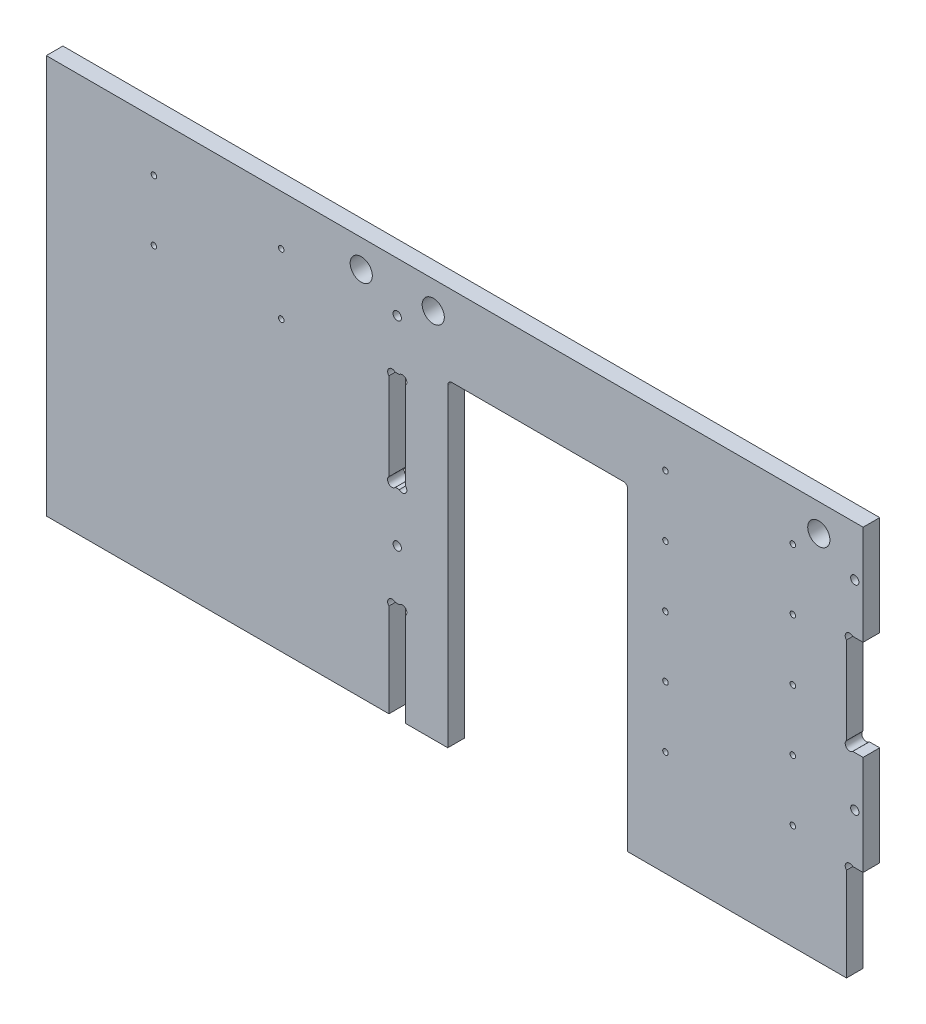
SolidWorks part; units mm, degrees
ref_plane "Plan de face" through (0, 0, 0) normal (0, 0, 1) x (1, 0, 0)
ref_plane "Plan de dessus" through (0, 0, 0) normal (0, 1, 0) x (1, 0, 0)
ref_plane "Plan de droite" through (0, 0, 0) normal (1, 0, 0) x (0, 0, -1)
sketch "Esquisse1" plane through (0, 0, 0) normal (0, 0, 1) x (1, 0, 0)
  line L0 (0, 0) -> (289, 0)
  line L1 (0, -55) -> (0, 55) construction
  line L2 (55, 0) -> (-55, 0) construction
  line L3 (289, 0) -> (289, 36)
  line L4 (289, 36) -> (295, 36)
  line L5 (295, 36) -> (295, 72)
  line L6 (295, 72) -> (289, 72)
  line L7 (289, 72) -> (289, 108)
  line L8 (289, 108) -> (295, 108)
  line L9 (295, 108) -> (295, 144)
  line L10 (295, 144) -> (0, 144)
  line L11 (0, 144) -> (0, 0)
  dimension "D1" = 144
  dimension "D2" = 36
  dimension "D3" = 6
  dimension "D4" = 295
extrude "Extrusion1" add sketch "Esquisse1" along normal blind 6
sketch "Esquisse2" plane through (0, 0, 6) normal (0, 0, 1) x (1, 0, 0)
  line L0 (289, 108) -> (297.353, 99.647) construction
  line L1 (289, 72) -> (289, 108) construction
  line L2 (289, 72) -> (295.6918, 78.6918) construction
  line L3 (295, 72) -> (289, 72) construction
  line L4 (289, 36) -> (297.4811, 27.5189) construction
  line L5 (289, 36) -> (295, 36) construction
  line L6 (289, 108) -> (295, 108) construction
  line L7 (289, 0) -> (289, 36) construction
  circle A0 centre (290.1314, 106.8686) radius 1.6
  circle A1 centre (290.1314, 73.1314) radius 1.6
  circle A2 centre (290.1314, 34.8686) radius 1.6
  dimension "D1" = 3.2
  dimension "D2" = 3.2
  dimension "D3" = 45
  dimension "D4" = 45
  dimension "D5" = 45
extrude "Enlèv. mat.-Extru.1" cut sketch "Esquisse2" against normal through all
sketch "Esquisse3" plane through (0, 0, 6) normal (0, 0, 1) x (1, 0, 0)
  line L0 (0, 0) -> (289, 0) construction
  line L1 (145, 0) -> (210, 0)
  line L2 (145, 0) -> (145, 113.5)
  line L3 (146.5, 115) -> (208.5, 115)
  line L4 (210, 0) -> (210, 113.5)
  line L5 (0, 144) -> (0, 0) construction
  arc A0 (146.5, 115) -> (145, 113.5) centre (146.5, 113.5) ccw
  arc A1 (210, 113.5) -> (208.5, 115) centre (208.5, 113.5) ccw
  dimension "D4" = 1.5
  dimension "D1" = 145
  dimension "D2" = 65
  dimension "D3" = 115
extrude "Enlèv. mat.-Extru.2" cut sketch "Esquisse3" against normal through all
sketch "Esquisse5" plane through (0, 0, 6) normal (0, 0, 1) x (1, 0, 0)
  line L0 (126.75, 144) -> (126.75, 0) construction
  line L1 (295, 144) -> (0, 144) construction
  line L2 (0, 0) -> (145, 0) construction
  line L4 (0, 144) -> (0, 0) construction
  line L5 (295, 54) -> (93.5701, 54) construction
  line L6 (295, 36) -> (295, 72) construction
  line L7 (289, 90) -> (93.5701, 90) construction
  line L8 (289, 74.2627) -> (289, 105.7373) construction
  line L9 (295, 126) -> (93.5701, 126) construction
  line L10 (295, 108) -> (295, 144) construction
  line L11 (291.2627, 36) -> (295, 36) construction
  line L12 (129.75, 108) -> (123.75, 108)
  line L13 (129.75, 108) -> (129.75, 72)
  line L14 (129.75, 72) -> (123.75, 72)
  line L15 (123.75, 108) -> (123.75, 72)
  line L16 (123.75, 0) -> (129.75, 0)
  line L17 (123.75, 0) -> (123.75, 36)
  line L18 (123.75, 36) -> (129.75, 36)
  line L19 (129.75, 0) -> (129.75, 36)
  dimension "D1" = 126.75
  dimension "D2" = 6
  dimension "D3" = 6
extrude "Enlèv. mat.-Extru.3" cut sketch "Esquisse5" against normal through all
sketch "Esquisse6" plane through (0, 0, 6) normal (0, 0, 1) x (1, 0, 0)
  line L0 (129.75, 36) -> (122.5492, 28.7992) construction
  line L1 (129.75, 36) -> (123.75, 36) construction
  line L2 (123.75, 36) -> (122.9351, 36.8149) construction
  line L3 (123.75, 36) -> (123.75, 0) construction
  line L4 (129.75, 72) -> (126.75, 75) construction
  line L5 (129.75, 108) -> (129.75, 72) construction
  line L6 (129.75, 72) -> (123.75, 72) construction
  line L7 (123.75, 71.8568) -> (126.75, 75) construction
  line L8 (129.75, 108) -> (126.75, 105) construction
  line L9 (123.75, 108) -> (129.75, 108) construction
  line L10 (123.75, 108) -> (126.75, 105) construction
  line L11 (123.75, 72) -> (123.75, 108) construction
  line L12 (126.75, 108) -> (126.75, 97.8594) construction
  line L13 (126.75, 72) -> (126.75, 75) construction
  line L14 (123.75, 72) -> (129.75, 72) construction
  line L15 (129.75, 72) -> (129.75, 108) construction
  line L16 (129.75, 0) -> (129.75, 36) construction
  circle A0 centre (124.8814, 106.8686) radius 1.6
  circle A1 centre (128.6186, 106.8686) radius 1.6
  circle A2 centre (128.6186, 73.1314) radius 1.6
  circle A3 centre (124.8547, 73.0142) radius 1.6
  circle A4 centre (124.8814, 34.8686) radius 1.6
  circle A5 centre (128.6186, 34.8686) radius 1.6
  dimension "D1" = 3.2
  dimension "D4" = 45
  dimension "D2" = 45
  dimension "D3" = 45
  dimension "D5" = 45
extrude "Enlèv. mat.-Extru.4" cut sketch "Esquisse6" against normal through all
sketch "Esquisse7" plane through (0, 0, 6) normal (0, 0, 1) x (1, 0, 0)
  line L0 (295, 134) -> (0, 134) construction
  line L1 (295, 108) -> (295, 144) construction
  line L2 (0, 144) -> (0, 0) construction
  line L3 (295, 144) -> (0, 144) construction
  line L4 (126.75, 36) -> (126.75, 144) construction
  line L5 (127.4873, 36) -> (126.0127, 36) construction
  line L6 (289, 74.2627) -> (289, 105.7373) construction
  line L7 (292, 144) -> (292, 25.9389) construction
  line L8 (0, 126) -> (305, 126) construction
  line L9 (0, 104) -> (328.4048, 104) construction
  line L10 (210, 82) -> (279.8627, 82) construction
  line L11 (210, 0) -> (210, 113.5) construction
  line L12 (210, 60) -> (279.8627, 60) construction
  line L13 (210, 38) -> (279.8627, 38) construction
  line L14 (223.6209, 38) -> (223.6209, 157.9847) construction
  line L15 (269.6209, 38) -> (269.6209, 169.6049) construction
  line L16 (61.875, 0) -> (61.875, 152.0978) construction
  line L17 (0, 0) -> (123.75, 0) construction
  line L18 (84.875, 97.983) -> (84.875, 152.0978) construction
  line L19 (38.875, 104) -> (38.875, 126) construction
  line L20 (129.75, 74.2627) -> (129.75, 105.7373) construction
  line L21 (295, 54) -> (281.04, 54) construction
  line L22 (295, 36) -> (295, 72) construction
  line L23 (117.7595, 54) -> (134.8445, 54) construction
  line L24 (119.9743, 126) -> (131.997, 126) construction
  line L25 (295, 144) -> (0, 144) construction
  circle A0 centre (279, 134) radius 4
  circle A1 centre (139.75, 134) radius 4
  circle A2 centre (113.75, 134) radius 4
  circle A3 centre (223.6209, 126) radius 1
  circle A4 centre (269.6209, 126) radius 1
  circle A5 centre (269.6209, 104) radius 1
  circle A6 centre (269.6209, 82) radius 1
  circle A7 centre (269.6209, 60) radius 1
  circle A8 centre (269.6209, 38) radius 1
  circle A9 centre (223.6209, 38) radius 1
  circle A10 centre (223.6209, 60) radius 1
  circle A11 centre (223.6209, 82) radius 1
  circle A12 centre (223.6209, 104) radius 1
  circle A13 centre (84.875, 126) radius 1
  circle A14 centre (84.875, 104) radius 1
  circle A15 centre (38.875, 126) radius 1
  circle A16 centre (38.875, 104) radius 1
  circle A17 centre (292, 126) radius 1.5
  circle A18 centre (292, 54) radius 1.5
  circle A19 centre (126.75, 54) radius 1.5
  circle A20 centre (126.75, 126) radius 1.5
  dimension "D2" = 8
  dimension "D12" = 2
  dimension "D14" = 3
  dimension "D16" = 3
  dimension "D1" = 10
  dimension "D3" = 10
  dimension "D4" = 10
  dimension "D5" = 18
  dimension "D6" = 22
  dimension "D7" = 22
  dimension "D8" = 22
  dimension "D9" = 22
  dimension "D10" = 46
  dimension "D11" = 46
  dimension "D13" = 3
  dimension "D15" = 18
extrude "Enlèv. mat.-Extru.5" cut sketch "Esquisse7" against normal through all
